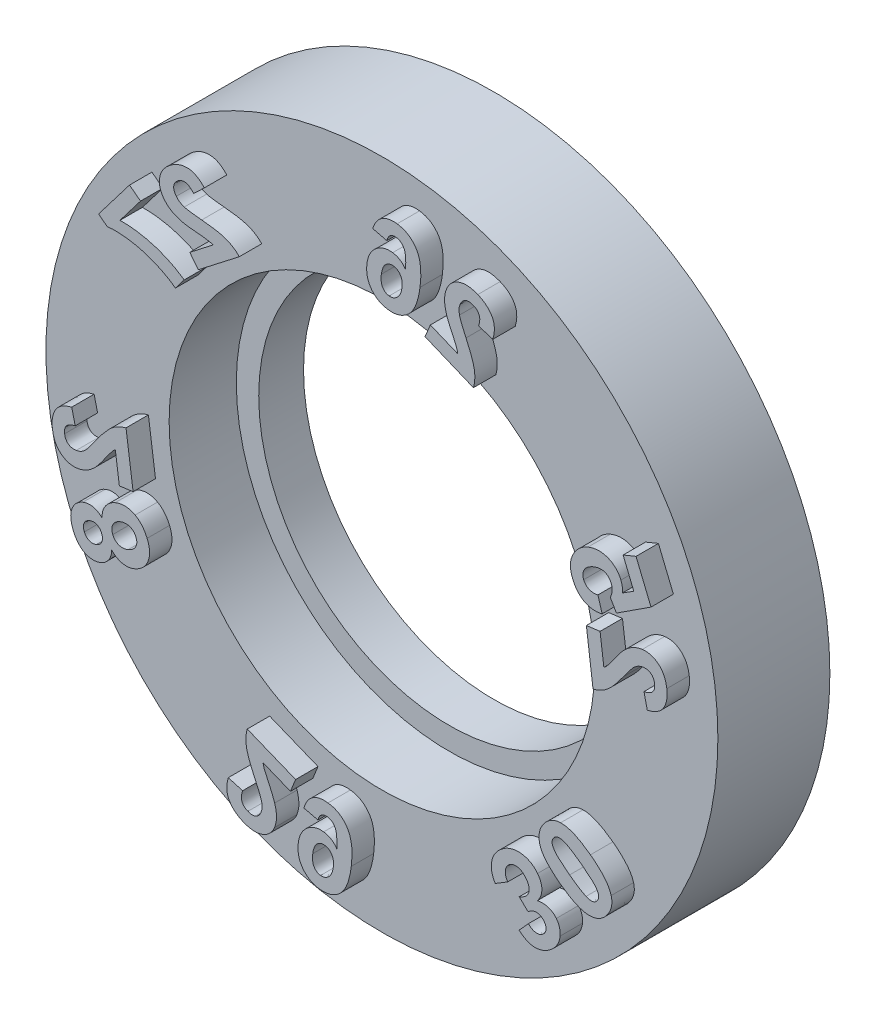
SolidWorks part; units mm, degrees
ref_plane "Front Plane" through (0, 0, 0) normal (0, 0, 1) x (1, 0, 0)
ref_plane "Top Plane" through (0, 0, 0) normal (0, 1, 0) x (1, 0, 0)
ref_plane "Right Plane" through (0, 0, 0) normal (1, 0, 0) x (0, 0, -1)
imported_body "Imported1"
other "DeleteFace3"
sketch "Sketch1" plane through (0, 0, 0) normal (0, 0, 1) x (1, 0, 0)
  circle A0 centre (0, 0) radius 10.4416 construction
  text T0 "25    26    27    28    29    30" font "Arial" height 3.5
extrude "Boss-Extrude1" add sketch "Sketch1" along normal blind 1
